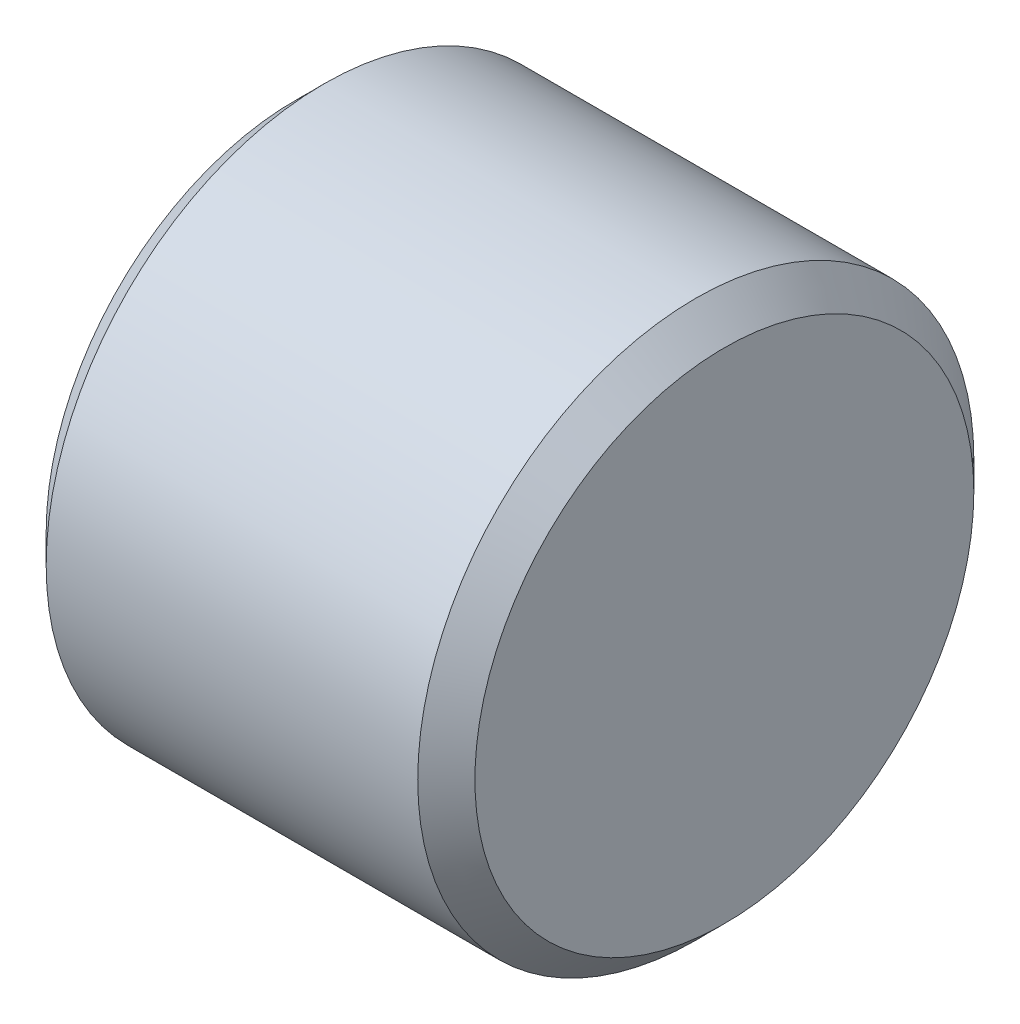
SolidWorks part; units mm, degrees
ref_plane "前视基准面" through (0, 0, 0) normal (0, 0, 1) x (1, 0, 0)
ref_plane "上视基准面" through (0, 0, 0) normal (0, 1, 0) x (1, 0, 0)
ref_plane "右视基准面" through (0, 0, 0) normal (1, 0, 0) x (0, 0, -1)
other "Configuration Table"
sketch "草图1" plane through (0, 0, 0) normal (0, 0, 1) x (1, 0, 0)
  line L1 (0, 0) -> (-7.5, 0)
  line L2 (0, 0) -> (0, 4.864)
  line L3 (0, 4.864) -> (-7.5, 4.864)
  line L4 (-7.5, 0) -> (-7.5, 4.864)
  dimension "D1" = 7.5
  dimension "D2" = 4.864
revolve "旋转1" add sketch "草图1" angle 360 about L1
sketch "草图2" plane through (-7.5, 0, 0) normal (-1, 0, 0) x (0, 0, 1)
  circle A0 centre (0.0693, 0) radius 0.6
  dimension "D1" = 1.2
extrude "切除-拉伸1" cut sketch "草图2" against normal blind 2
chamfer "倒角1" distance 0.5 angle 45 2 edges at (0, 0, -4.864) (-7.5, 0, -4.864)
